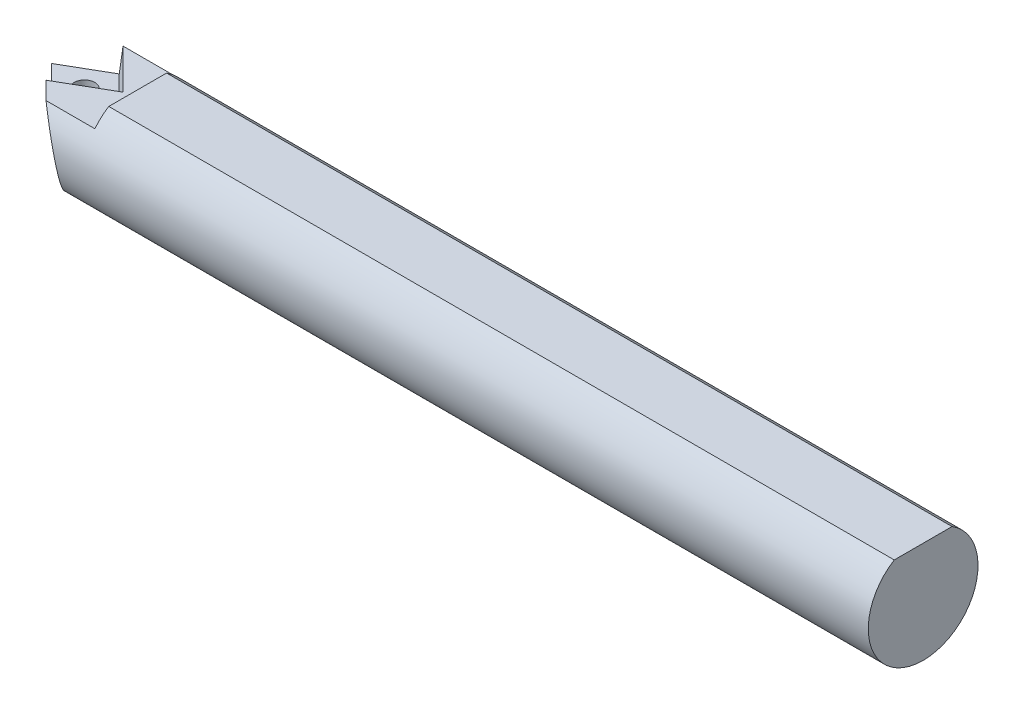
SolidWorks part; units mm, degrees
ref_plane "Front Plane" through (0, 0, 0) normal (0, 0, 1) x (1, 0, 0)
ref_plane "Top Plane" through (0, 0, 0) normal (0, 1, 0) x (1, 0, 0)
ref_plane "Right Plane" through (0, 0, 0) normal (1, 0, 0) x (0, 0, -1)
sketch "Sketch1" plane through (0, 0, 0) normal (1, 0, 0) x (0, 0, -1)
  circle A0 centre (0, 0) radius 8
  dimension "D1" = 16
extrude "Boss-Extrude1" add sketch "Sketch1" along normal mid plane 130
ref_plane "Plane1" through (0, 6.8, 0) normal (0, 1, 0) x (1, 0, 0)
sketch "Sketch3" plane through (0, 6.8, 0) normal (0, 1, 0) x (1, 0, 0)
  line L1 (72.2281, -10.3573) -> (-72.2281, -10.3573)
  line L2 (72.2281, -10.3573) -> (72.2281, 10.3573)
  line L3 (72.2281, 10.3573) -> (-72.2281, 10.3573)
  line L4 (-72.2281, -10.3573) -> (-72.2281, 10.3573)
  line L5 (72.2281, -10.3573) -> (-72.2281, 10.3573) construction
  line L6 (72.2281, 10.3573) -> (-72.2281, -10.3573) construction
  point P0 (0, 0)
extrude "Cut-Extrude1" cut sketch "Sketch3" along normal through all
sketch "Sketch7" plane through (-65, 0, 0) normal (-1, 0, 0) x (0, 0, 1)
  line L0 (-4.2143, 6.8) -> (4.2143, 6.8) construction
  line L1 (-9.5921, 5) -> (9.2826, 5)
  line L2 (-9.5921, 5) -> (-9.5921, 6.8)
  line L3 (-9.5921, 6.8) -> (9.2826, 6.8)
  line L4 (9.2826, 5) -> (9.2826, 6.8)
  dimension "D1" = 1.8
extrude "Cut-Extrude2" cut sketch "Sketch7" against normal blind 15.5 contours L3 L4 L1 L2
sketch "Sketch8" plane through (0, 5, 0) normal (0, 1, 0) x (1, 0, 0)
  line L0 (-65, 2.135) -> (-57.8812, 6.245)
  line L1 (-65, 6.245) -> (-65, -6.245) construction
  line L2 (-65, 6.245) -> (-49.5, 6.245) construction
  line L3 (-57.8812, 6.245) -> (-52.0687, 0.4325)
  line L4 (-52.0687, 0.4325) -> (-59.1875, -3.6775)
  line L5 (-59.1875, -3.6775) -> (-65, 2.135)
  line L6 (-52.0687, 0.4325) -> (-65, 2.135) construction
  line L7 (-57.8812, 6.245) -> (-58.5344, 1.2837) construction
  line L8 (-58.5344, 1.2837) -> (-59.1875, -3.6775) construction
  circle A0 centre (-58.5344, 1.2837) radius 3.97 construction
  point P10 (-60.7457, -4.9149)
  point P11 (-51.2438, -1.2655)
  point P12 (-59.294, -0.1789)
  point P13 (-65, 1.7217)
  dimension "D1" = 7.94
  dimension "D2" = 75
  dimension "D3" = 75
  dimension "D4" = 60
extrude "Cut-Extrude3" cut sketch "Sketch8" against normal blind 3.18 draft 7
sketch "Sketch9" plane through (0, 1.82, 0) normal (0, 1, 0) x (1, 0, 0)
  line L0 (-59.1233, -3.1896) -> (-57.9454, 5.7571) construction
  circle A0 centre (-58.5344, 1.2837) radius 1.5
  dimension "D1" = 3
extrude "Cut-Extrude4" cut sketch "Sketch9" against normal through all
sketch "Sketch10" plane through (0, 5, 0) normal (0, 1, 0) x (1, 0, 0)
  line L0 (-59.1875, -3.6775) -> (-49.6759, -13.1891)
  line L1 (-49.6759, -13.1891) -> (-71.1456, -13.5299)
  line L2 (-71.1456, -13.5299) -> (-72.6215, 15.8333)
  line L3 (-72.6215, 15.8333) -> (-52.1904, 14.8759)
  line L4 (-57.8812, 6.245) -> (-50.694, 10.3945)
  line L5 (-65, 6.245) -> (-65, 2.135) construction
  line L6 (-50.694, 10.3945) -> (-52.1904, 14.8759)
  line L7 (-57.8812, 6.245) -> (-71.7374, -1.7549)
  line L8 (-59.1875, -3.6775) -> (-72.2999, 9.4348)
  dimension "D1" = 60
extrude "Cut-Extrude5" cut sketch "Sketch10" against normal through all draft 10 contours L8 L7 L4 L6 L3 L2 | L7 L8 L2 | L3 L7 L2 L1 L0 | L0 L8 L3 L2
